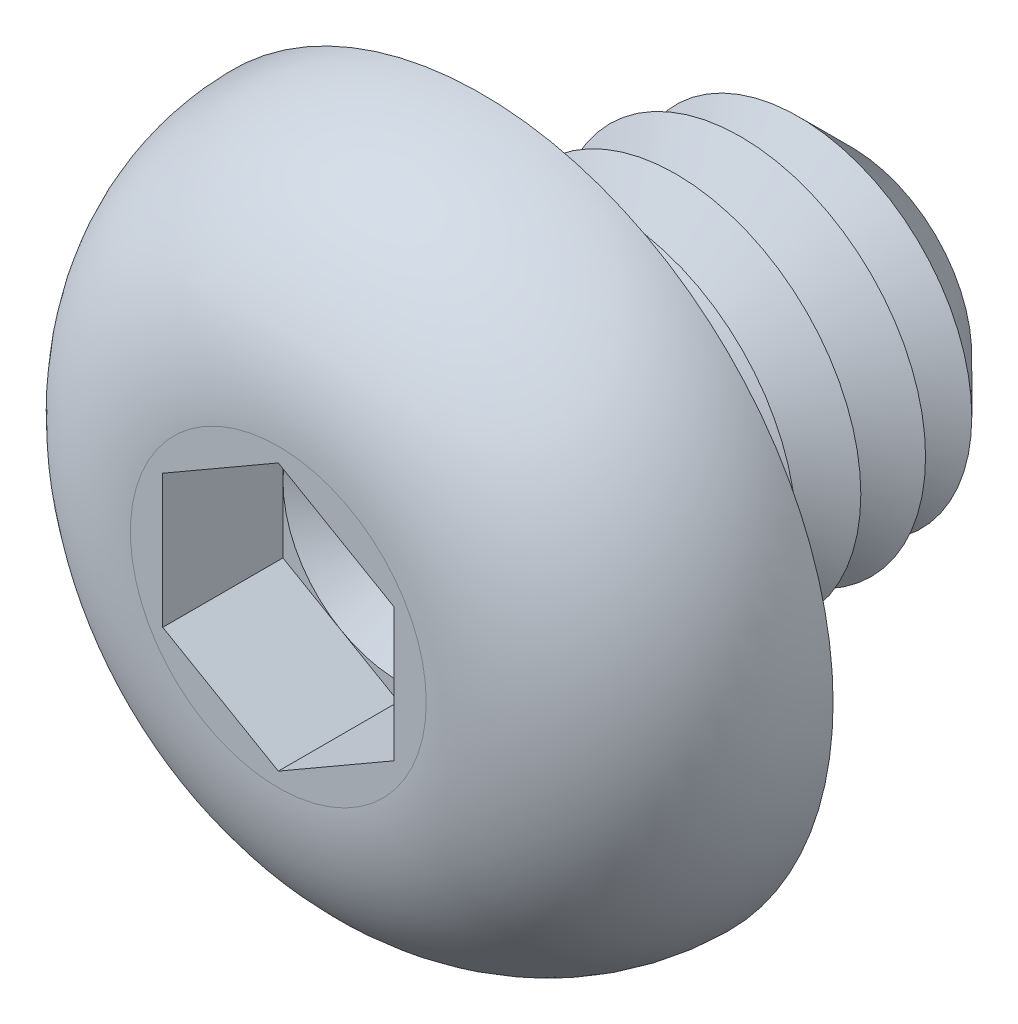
SolidWorks part; units mm, degrees
ref_plane "Front Plane" through (0, 0, 0) normal (0, 0, 1) x (1, 0, 0)
ref_plane "Top Plane" through (0, 0, 0) normal (0, 1, 0) x (1, 0, 0)
ref_plane "Right Plane" through (0, 0, 0) normal (1, 0, 0) x (0, 0, -1)
sketch "Sketch1" plane through (0, 0, 0) normal (1, 0, 0) x (0, 0, -1)
  line L0 (-47.9342, 0) -> (60.3146, 0) construction
sketch "Sketch2" plane through (0, 0, 0) normal (1, 0, 0) x (0, 0, -1)
  line L0 (0, 0) -> (-2.2, 0)
  line L1 (-47.9342, 0) -> (60.3146, 0) construction
  line L2 (-2.2, 0) -> (-2.2, 1.6)
  line L3 (0, 3.8) -> (0, 0)
  arc A0 (-2.2, 1.6) -> (0, 3.8) centre (0, 1.6) cw
  dimension "D1" = 2.2
  dimension "D2" = 2.2
  dimension "D3" = 3.8
revolve "Revolve1" add sketch "Sketch2" angle 360 about L0
sketch "Sketch3" plane through (0, 0, 2.2) normal (0, 0, 1) x (1, 0, 0)
  line L1 (0, 1.4434) -> (-1.25, 0.7217)
  line L2 (-1.25, 0.7217) -> (-1.25, -0.7217)
  line L3 (-1.25, -0.7217) -> (0, -1.4434)
  line L4 (0, -1.4434) -> (1.25, -0.7217)
  line L5 (1.25, -0.7217) -> (1.25, 0.7217)
  line L6 (1.25, 0.7217) -> (0, 1.4434)
  circle A0 centre (0, 0) radius 1.25 construction
  dimension "D1" = 2.5
extrude "Cut-Extrude1" cut sketch "Sketch3" against normal blind 1.3
sketch "Sketch4" plane through (0, 0, 0) normal (0, 0, -1) x (-1, 0, 0)
  circle A0 centre (0, 0) radius 2
  dimension "D1" = 4
extrude "Boss-Extrude1" add sketch "Sketch4" along normal blind 4
chamfer "Chamfer1" distance 0.7 angle 45 1 edges at (-2, 0, -4)
sketch "Sketch5" plane through (0, 0, 0) normal (1, 0, 0) x (0, 0, -1)
  line L0 (0.7, 2) -> (1.4, 2)
  line L1 (3.3, 2) -> (0, 2) construction
  line L2 (1.4, 2) -> (1.05, 1.3938)
  line L3 (1.05, 1.3938) -> (0.7, 2)
  line L4 (0, -3.8) -> (0, 3.8) construction
  line L5 (3.3, 2) -> (0, 2) construction
  dimension "D1" = 0.7
  dimension "D2" = 0.7
revolve "Cut-Revolve1" cut sketch "Sketch5" angle 360 about L0
pattern_linear "LPattern1" count 4 spacing 0.7 along (0, 0, -1) of "Cut-Revolve1"
fillet "Fillet2" radius 0.3 1 edges at (2, 0, 0)
sketch "Sketch6" plane through (0, 0, 0.9) normal (0, 0, 1) x (1, 0, 0)
  line L0 (0, -1.4434) -> (1.25, -0.7217) construction
  circle A0 centre (0, 0) radius 1.25
extrude "Cut-Extrude2" cut sketch "Sketch6" against normal through all draft 60
